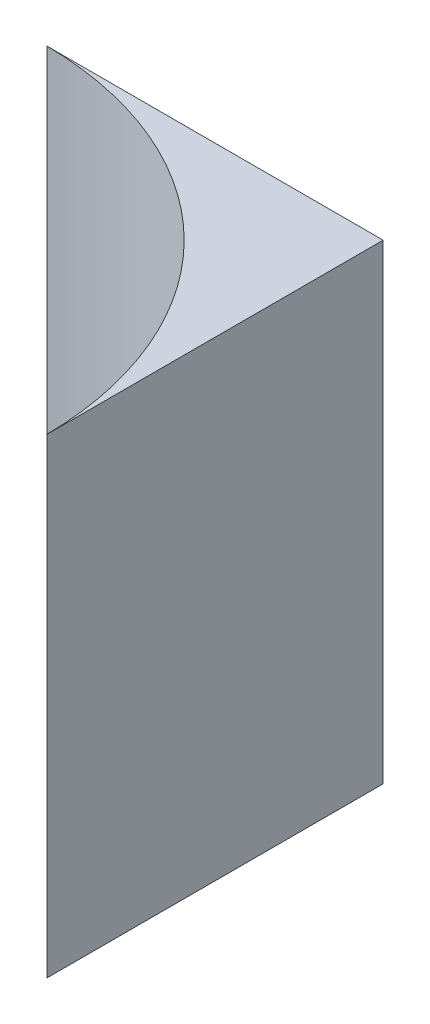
SolidWorks part; units mm, degrees
ref_plane "Front Plane" through (0, 0, 0) normal (0, 0, 1) x (1, 0, 0)
ref_plane "Top Plane" through (0, 0, 0) normal (0, 1, 0) x (1, 0, 0)
ref_plane "Right Plane" through (0, 0, 0) normal (1, 0, 0) x (0, 0, -1)
sketch "Sketch1" plane through (0, 0, 0) normal (0, 1, 0) x (1, 0, 0)
  line L1 (-25, -25) -> (25, -25)
  line L2 (-25, -25) -> (-25, 25)
  line L3 (-25, 25) -> (25, 25)
  line L4 (25, -25) -> (25, 25)
  line L5 (-25, -25) -> (25, 25) construction
  line L6 (-25, 25) -> (25, -25) construction
  line L7 (-25.25, -25.25) -> (25.25, -25.25) construction
  line L8 (-25.25, -25.25) -> (-25.25, 25.25) construction
  line L9 (-25.25, 25.25) -> (25.25, 25.25) construction
  line L10 (25.25, -25.25) -> (25.25, 25.25) construction
  line L11 (-25.25, -25.25) -> (25.25, 25.25) construction
  line L12 (-25.25, 25.25) -> (25.25, -25.25) construction
  circle A1 centre (-25.25, 25.25) radius 25.25
  circle A4 centre (25.25, 25.25) radius 25.25
  circle A5 centre (25.25, -25.25) radius 25.25
  circle A6 centre (-25.25, -25.25) radius 25.25
  point P0 (0, 0)
  point P6 (0, 0)
  dimension "D5" = 50.5
  dimension "D6" = 50.5
  dimension "D7" = 50.5
  dimension "D8" = 50.5
  dimension "D1" = 50
  dimension "D2" = 50
  dimension "D3" = 50.5
  dimension "D4" = 50.5
extrude "Boss-Extrude1" add sketch "Sketch1" along normal blind 35 contours A6 L4 A5 L3 A1 L2 A4 L1
sketch "Sketch2" plane through (0, 35, 0) normal (0, 1, 0) x (1, 0, 0)
  line L1 (0.0012, 25) -> (33.9039, 25)
  line L2 (0.0012, 25) -> (0.0012, -26.398)
  line L3 (0.0012, -26.398) -> (33.9039, -26.398)
  line L4 (33.9039, 25) -> (33.9039, -26.398)
extrude "Cut-Extrude1" cut sketch "Sketch2" against normal through all
sketch "Sketch3" plane through (0, 35, 0) normal (0, 1, 0) x (1, 0, 0)
  line L1 (-25, 0.0012) -> (28.9627, 0.0012)
  line L2 (-25, 0.0012) -> (-25, 25.9527)
  line L3 (-25, 25.9527) -> (28.9627, 25.9527)
  line L4 (28.9627, 0.0012) -> (28.9627, 25.9527)
extrude "Cut-Extrude2" cut sketch "Sketch3" against normal through all
scale "Scale1" scale about centroid uniform scaling yes scale factor 0.9
